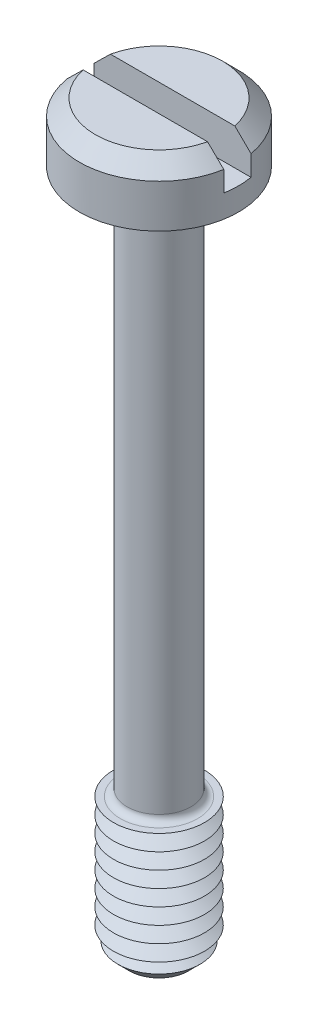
SolidWorks part; units mm, degrees
ref_plane "Front Plane" through (0, 0, 0) normal (0, 0, 1) x (1, 0, 0)
ref_plane "Top Plane" through (0, 0, 0) normal (0, 1, 0) x (1, 0, 0)
ref_plane "Right Plane" through (0, 0, 0) normal (1, 0, 0) x (0, 0, -1)
sketch "Sketch1" plane through (0, 0, 0) normal (0, 1, 0) x (1, 0, 0)
  circle A0 centre (0, 0) radius 3.5
  dimension "D1" = 7
extrude "Boss-Extrude1" add sketch "Sketch1" along normal blind 2.6
sketch "Sketch2" plane through (0, 0, 0) normal (0, -1, 0) x (1, 0, 0)
  circle A0 centre (0, 0) radius 1.4
  dimension "D1" = 2.8
extrude "Boss-Extrude2" add sketch "Sketch2" along normal blind 30
sketch "Sketch3" plane through (0, -30, 0) normal (0, -1, 0) x (1, 0, 0)
  circle A0 centre (0, 0) radius 2
  dimension "D1" = 4
extrude "Boss-Extrude3" add sketch "Sketch3" against normal blind 6
chamfer "Chamfer1" distance 0.7 angle 45 1 edges at (0, -30, -2)
sketch "Sketch4" plane through (0, 0, 0) normal (1, 0, 0) x (0, 0, -1)
  line L0 (0, -6.5871) -> (0, -12.0372) construction
sketch "Sketch5" plane through (0, 0, 0) normal (1, 0, 0) x (0, 0, -1)
  line L0 (-2, -24) -> (-1.3938, -24.35)
  line L1 (-1.3938, -24.35) -> (-2, -24.7)
  line L2 (-2, -24) -> (-2, -29.3) construction
  line L3 (-2, -24.7) -> (-2, -24)
  dimension "D1" = 0.7
revolve "Cut-Revolve1" cut sketch "Sketch5" angle 360 about L0
pattern_linear "LPattern1" count 8 spacing 0.7 along (0, -1, 0) of "Cut-Revolve1"
fillet "Fillet1" radius 0.3 2 edges at (0, -24, -1.4) (0, 0, -1.4)
chamfer "Chamfer2" distance 0.7 angle 45 1 edges at (0, 2.6, 3.5)
sketch "Sketch6" plane through (0, 2.6, 0) normal (0, 1, 0) x (1, 0, 0)
  line L1 (3.5, -0.6) -> (-3.5, -0.6)
  line L2 (3.5, -0.6) -> (3.5, 0.6)
  line L3 (3.5, 0.6) -> (-3.5, 0.6)
  line L4 (-3.5, -0.6) -> (-3.5, 0.6)
  line L5 (3.5, -0.6) -> (-3.5, 0.6) construction
  line L6 (3.5, 0.6) -> (-3.5, -0.6) construction
  circle A0 centre (0, 0) radius 3.5 construction
  point P0 (0, 0)
  dimension "D1" = 1.2
extrude "Cut-Extrude1" cut sketch "Sketch6" against normal blind 1.6
